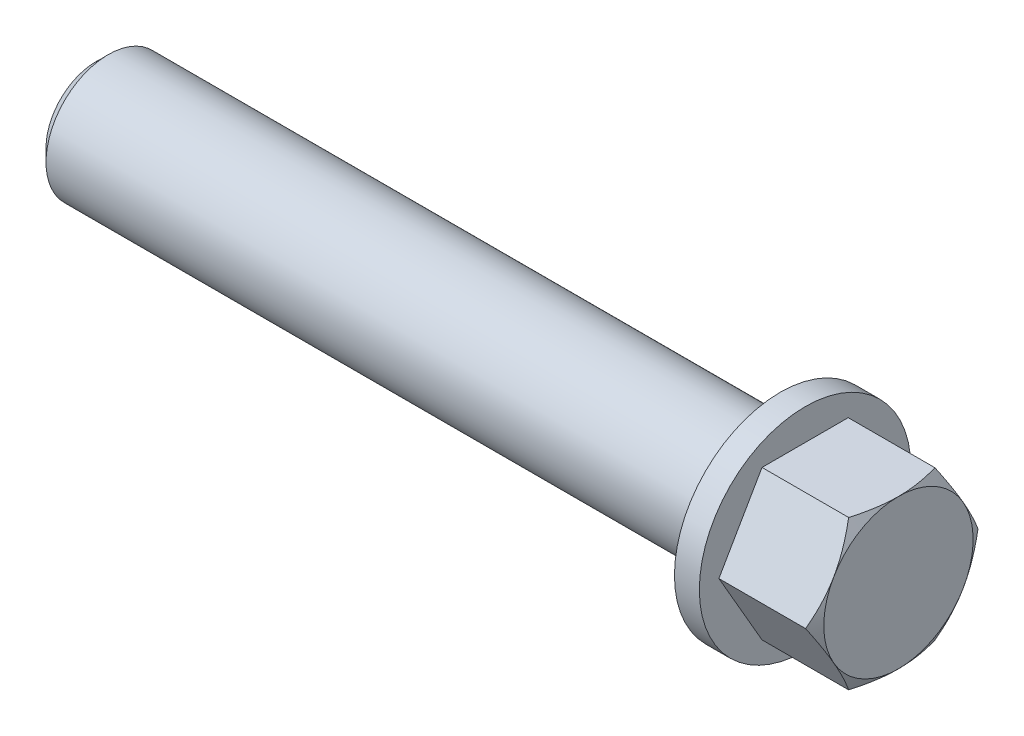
SolidWorks part; units mm, degrees
ref_plane "Face" through (0, 0, 0) normal (0, 0, 1) x (1, 0, 0)
ref_plane "Dessus" through (0, 0, 0) normal (0, 1, 0) x (1, 0, 0)
ref_plane "Droite" through (0, 0, 0) normal (1, 0, 0) x (0, 0, -1)
sketch "Esquisse1" plane through (0, 0, 0) normal (1, 0, 0) x (0, 0, -1)
  line L0 (6.9282, 0) -> (3.4641, 6)
  line L1 (3.4641, 6) -> (-3.4641, 6)
  line L2 (-3.4641, 6) -> (-6.9282, 0)
  line L3 (-6.9282, 0) -> (-3.4641, -6)
  line L4 (-3.4641, -6) -> (3.4641, -6)
  line L5 (3.4641, -6) -> (6.9282, 0)
  line L6 (0, 0) -> (31, 0) construction
  circle A0 centre (0, 0) radius 6.9282 construction
  dimension "D1" = 12
extrude "Base-Extrusion" add sketch "Esquisse1" along normal blind 7.5
sketch "Esquisse2" plane through (0, 0, 0) normal (-1, 0, 0) x (0, 0, 1)
  circle A0 centre (0, 0) radius 5
  dimension "D1" = 10
extrude "Boss.-Extru.1" add sketch "Esquisse2" along normal blind 57
sketch "Esquisse3" plane through (0, 0, 0) normal (0, 0, 1) x (1, 0, 0)
  line L0 (7.5, -6) -> (0, -18.9904)
  line L1 (0, -18.9904) -> (7.5, -18.9904)
  line L2 (7.5, -18.9904) -> (7.5, -6)
  line L3 (3.75, -12.4952) -> (7.5, -18.9904) construction
  line L4 (0, 0) -> (0, -6) construction
  line L5 (0, 0) -> (12.7759, 0) construction
  line L6 (-57, 0) -> (0, 0) construction
revolve "Enlèvement de matière-Révolution1" cut sketch "Esquisse3" angle 360 about L5
chamfer "Chanfrein1" distance 1 angle 45 1 edges at (-57, 0, 5)
sketch "Esquisse4" plane through (0, 0, 0) normal (0, 0, 1) x (1, 0, 0)
  line L0 (0, 0) -> (-110.7549, 0) construction
  line L2 (0, 0) -> (-2, 0)
  line L3 (0, 0) -> (0, 8.5)
  line L4 (0, 8.5) -> (-2, 8.5)
  line L5 (-2, 0) -> (-2, 8.5)
  dimension "D1" = 2
  dimension "D2" = 17
revolve "Révolution1" add sketch "Esquisse4" angle 360 about L0
sketch "Esquisse5" plane through (0, 0, 0) normal (0, 0, 1) x (1, 0, 0)
  line L0 (-2, 5) -> (-2, -5) construction
  line L1 (-2, 0) -> (-36, 0)
  line L2 (-2, 0) -> (-2, 5)
  line L3 (-2, 5) -> (-36, 5)
  line L4 (-36, 0) -> (-36, 5)
  line L5 (0, 0) -> (-308.1157, 0) construction
  dimension "D1" = 10
  dimension "D2" = 34
revolve "Révolution2" add sketch "Esquisse5" angle 360 about L5
fillet "Congé1" radius 1
equation "\"D2@Représentation de filetage1\" = 0.8*\"D1@Esquisse2\""
equation "\"D1@Chanfrein1\" = 0.1*\"D1@Esquisse2\""
